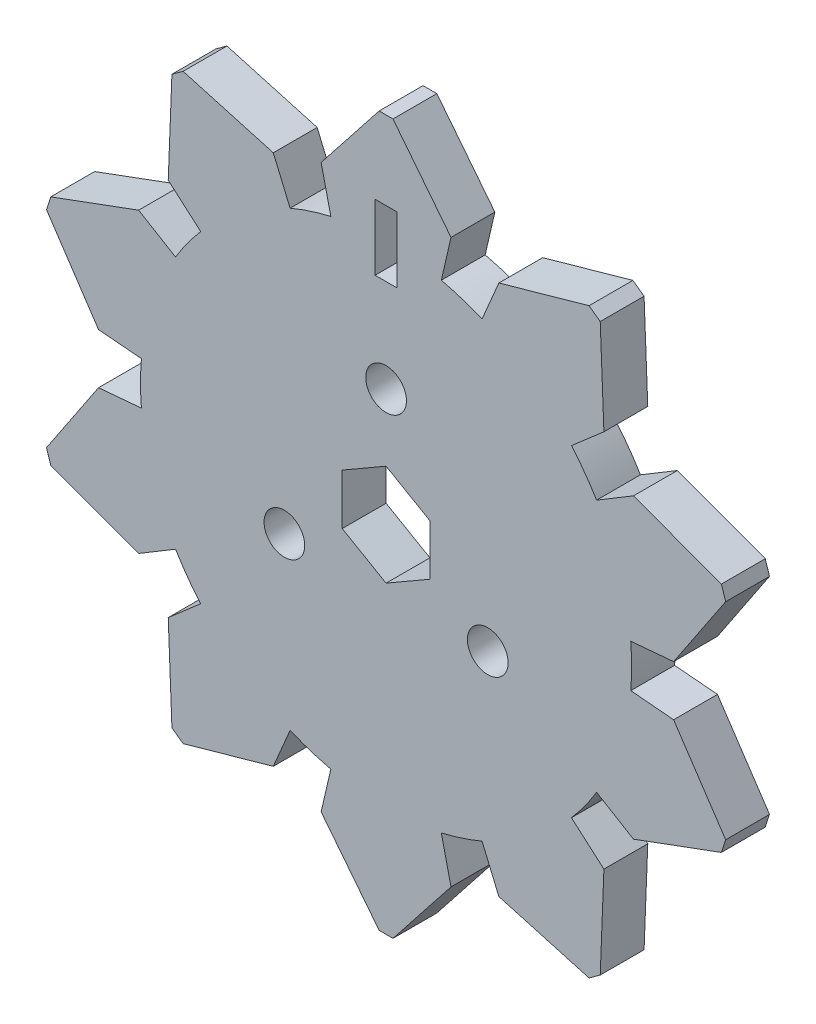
SolidWorks part; units mm, degrees
ref_plane "Front Plane" through (0, 0, 0) normal (0, 0, 1) x (1, 0, 0)
ref_plane "Top Plane" through (0, 0, 0) normal (0, 1, 0) x (1, 0, 0)
ref_plane "Right Plane" through (0, 0, 0) normal (1, 0, 0) x (0, 0, -1)
sketch "Sketch1" plane through (0, 0, 0) normal (0, 0, 1) x (1, 0, 0)
  line L0 (0, 26.2856) -> (0, -26.2856) construction
  line L1 (15.4503, 21.2655) -> (-15.4503, -21.2655) construction
  line L3 (-3.9996, 17.3243) -> (-4.7004, 20.3595)
  line L4 (-4.7004, 20.3595) -> (-0.5, 25.6863)
  line L5 (-0.5, 25.6863) -> (0.5, 25.6863)
  line L6 (4.7004, 20.3595) -> (0.5, 25.6863)
  line L7 (3.9996, 17.3243) -> (4.7004, 20.3595)
  line L8 (0, 0) -> (-6.9472, 16.3666) construction
  line L9 (6.9472, 16.3666) -> (8.1644, 19.234)
  line L10 (8.1644, 19.234) -> (14.6935, 21.0745)
  line L11 (14.6935, 21.0745) -> (15.5025, 20.4868)
  line L12 (15.7697, 13.7084) -> (15.5025, 20.4868)
  line L13 (13.4187, 11.6647) -> (15.7697, 13.7084)
  line L14 (15.2404, 9.1574) -> (17.9106, 10.7618)
  line L15 (17.9106, 10.7618) -> (24.2746, 8.413)
  line L16 (24.2746, 8.413) -> (24.5836, 7.462)
  line L17 (20.8156, 1.8211) -> (24.5836, 7.462)
  line L18 (17.7123, 1.5496) -> (20.8156, 1.8211)
  line L19 (17.7123, -1.5496) -> (20.8156, -1.8211)
  line L20 (20.8156, -1.8211) -> (24.5836, -7.462)
  line L21 (24.5836, -7.462) -> (24.2746, -8.413)
  line L22 (17.9106, -10.7618) -> (24.2746, -8.413)
  line L23 (15.2404, -9.1574) -> (17.9106, -10.7618)
  line L24 (13.4187, -11.6647) -> (15.7697, -13.7084)
  line L25 (15.7697, -13.7084) -> (15.5025, -20.4868)
  line L26 (15.5025, -20.4868) -> (14.6935, -21.0745)
  line L27 (8.1644, -19.234) -> (14.6935, -21.0745)
  line L28 (6.9472, -16.3666) -> (8.1644, -19.234)
  line L29 (3.9996, -17.3243) -> (4.7004, -20.3595)
  line L30 (4.7004, -20.3595) -> (0.5, -25.6863)
  line L31 (0.5, -25.6863) -> (-0.5, -25.6863)
  line L32 (-4.7004, -20.3595) -> (-0.5, -25.6863)
  line L33 (-3.9996, -17.3243) -> (-4.7004, -20.3595)
  line L34 (-6.9472, -16.3666) -> (-8.1644, -19.234)
  line L35 (-8.1644, -19.234) -> (-14.6935, -21.0745)
  line L36 (-14.6935, -21.0745) -> (-15.5025, -20.4868)
  line L37 (-15.7697, -13.7084) -> (-15.5025, -20.4868)
  line L38 (-13.4187, -11.6647) -> (-15.7697, -13.7084)
  line L39 (-15.2404, -9.1574) -> (-17.9106, -10.7618)
  line L40 (-17.9106, -10.7618) -> (-24.2746, -8.413)
  line L41 (-24.2746, -8.413) -> (-24.5836, -7.462)
  line L42 (-20.8156, -1.8211) -> (-24.5836, -7.462)
  line L43 (-17.7123, -1.5496) -> (-20.8156, -1.8211)
  line L44 (-17.7123, 1.5496) -> (-20.8156, 1.8211)
  line L45 (-20.8156, 1.8211) -> (-24.5836, 7.462)
  line L46 (-24.5836, 7.462) -> (-24.2746, 8.413)
  line L47 (-17.9106, 10.7618) -> (-24.2746, 8.413)
  line L48 (-15.2404, 9.1574) -> (-17.9106, 10.7618)
  line L49 (-13.4187, 11.6647) -> (-15.7697, 13.7084)
  line L50 (-15.7697, 13.7084) -> (-15.5025, 20.4868)
  line L51 (-15.5025, 20.4868) -> (-14.6935, 21.0745)
  line L52 (-8.1644, 19.234) -> (-14.6935, 21.0745)
  line L53 (-6.9472, 16.3666) -> (-8.1644, 19.234)
  line L55 (3.175, 1.8331) -> (0, 3.6662)
  line L56 (0, 3.6662) -> (-3.175, 1.8331)
  line L57 (-3.175, 1.8331) -> (-3.175, -1.8331)
  line L58 (-3.175, -1.8331) -> (0, -3.6662)
  line L59 (0, -3.6662) -> (3.175, -1.8331)
  line L60 (3.175, -1.8331) -> (3.175, 1.8331)
  circle A0 centre (0, 0) radius 3.175 construction
  arc A1 (-6.9472, 16.3666) -> (-3.9996, 17.3243) centre (0, 0) cw
  arc A2 (3.9996, 17.3243) -> (6.9472, 16.3666) centre (0, 0) cw
  arc A3 (13.4187, 11.6647) -> (15.2404, 9.1574) centre (0, 0) cw
  arc A4 (17.7123, 1.5496) -> (17.7123, -1.5496) centre (0, 0) cw
  arc A5 (15.2404, -9.1574) -> (13.4187, -11.6647) centre (0, 0) cw
  arc A6 (6.9472, -16.3666) -> (3.9996, -17.3243) centre (0, 0) cw
  arc A7 (-3.9996, -17.3243) -> (-6.9472, -16.3666) centre (0, 0) cw
  arc A8 (-13.4187, -11.6647) -> (-15.2404, -9.1574) centre (0, 0) cw
  arc A9 (-17.7123, -1.5496) -> (-17.7123, 1.5496) centre (0, 0) cw
  arc A10 (-15.2404, 9.1574) -> (-13.4187, 11.6647) centre (0, 0) cw
  point P7 (0, 0)
  point P8 (0, 0)
  point P17 (0, 25.6863)
  point P96 (0, 0)
  dimension "D1" = 6.35
  dimension "D6" = 6.7836
  dimension "D3" = 17.78
  dimension "D9" = 3.1032
  dimension "D2" = 36
  dimension "D4" = 13
  dimension "D5" = 0.5
  dimension "D8" = 38.257
  dimension "D7" = 10
extrude "Boss-Extrude1" add sketch "Sketch1" along normal blind 3.175
hole_wizard "#4 Clearance Hole1" positions "Sketch3" profile "Sketch2" hole size "#4" standard "ANSI Inch"
sketch "Sketch3" plane through (0, 0, 3.175) normal (0, 0, 1) x (1, 0, 0)
  point P0 (0, 8.5)
  point P11 (7.3612, -4.25)
  point P12 (-7.3612, -4.25)
  dimension "D1" = 8.5
  dimension "D2" = 3
sketch "Sketch2" plane through (0, 8.5, 3.175) normal (1, 0, 0) x (0, -1, 0)
  line L0 (0, 0) -> (0, 3.175)
  line L1 (0, 3.175) -> (1.4732, 3.175)
  line L2 (1.4732, 3.175) -> (1.4732, 0)
  line L5 (1.4732, 0) -> (0, 0)
  line L11 (0, -6.35) -> (0, 107.95) construction
  dimension "Thru Hole Dia." = 2.9464
  dimension "Thru Hole Depth" = 3.175
sketch "Sketch4" plane through (0, 0, 3.175) normal (0, 0, 1) x (1, 0, 0)
  line L1 (-0.7938, 20.0025) -> (0.7938, 20.0025)
  line L2 (-0.7938, 20.0025) -> (-0.7937, 15.24)
  line L3 (-0.7937, 15.24) -> (0.7937, 15.24)
  line L4 (0.7938, 20.0025) -> (0.7937, 15.24)
  point P4 (0, 15.24)
  dimension "D1" = 1.5875
  dimension "D2" = 4.7625
  dimension "D3" = 15.24
extrude "Cut-Extrude1" cut sketch "Sketch4" against normal through all
